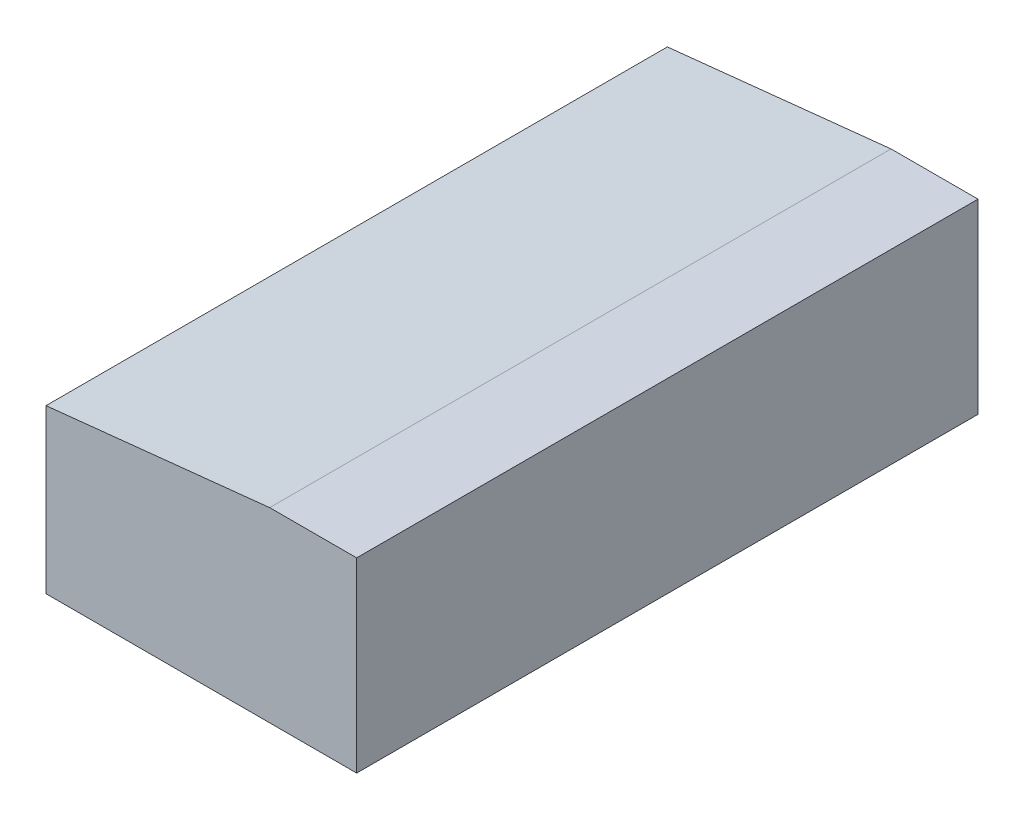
SolidWorks part; units mm, degrees
ref_plane "Plan de face" through (0, 0, 0) normal (0, 0, 1) x (1, 0, 0)
ref_plane "Plan de dessus" through (0, 0, 0) normal (0, 1, 0) x (1, 0, 0)
ref_plane "Plan de droite" through (0, 0, 0) normal (1, 0, 0) x (0, 0, -1)
sketch "Esquisse1" plane through (0, 0, 0) normal (0, 0, 1) x (1, 0, 0)
  line L0 (-7.0556, 0) -> (61.1481, 0) construction
  line L1 (0, 21.637) -> (0, -13.4056) construction
  line L2 (25, -13.4056) -> (25, 27.7519) construction
  line L3 (61.1481, 15) -> (-8.937, 15) construction
  line L5 (18, 16.9984) -> (18, 13.5649) construction
  line L6 (0, 13.1081) -> (18, 15)
  line L7 (18, 15) -> (25, 15)
  line L8 (25, 15) -> (25, 0)
  line L9 (25, 0) -> (0, 0)
  line L10 (0, 0) -> (0, 13.1081)
  dimension "D1" = 25
  dimension "D2" = 15
  dimension "D3" = 7
  dimension "D4" = 6
extrude "Extrusion1" add sketch "Esquisse1" along normal blind 50
